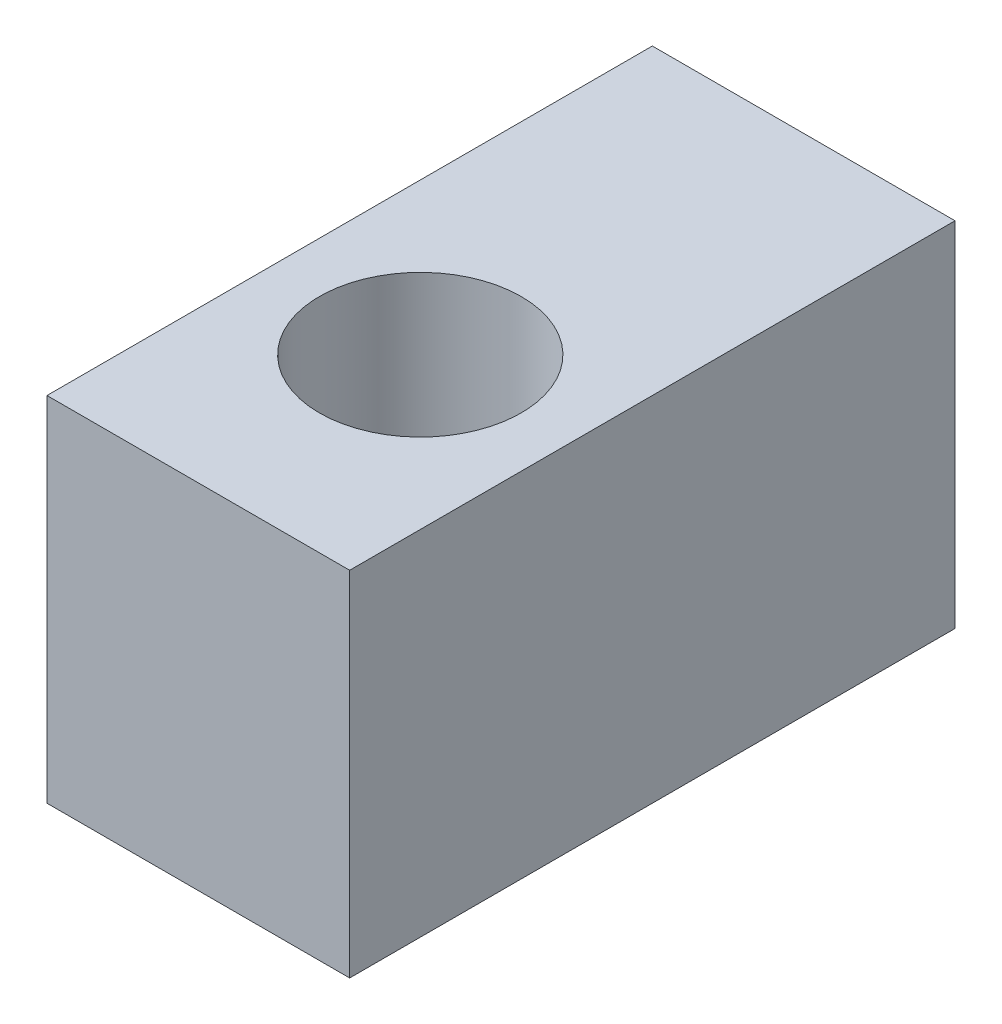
SolidWorks part; units mm, degrees
ref_plane "Front Plane" through (0, 0, 0) normal (0, 0, 1) x (1, 0, 0)
ref_plane "Top Plane" through (0, 0, 0) normal (0, 1, 0) x (1, 0, 0)
ref_plane "Right Plane" through (0, 0, 0) normal (1, 0, 0) x (0, 0, -1)
sketch "Sketch1" plane through (0, 0, 0) normal (0, 0, 1) x (1, 0, 0)
  line L1 (0, 0) -> (30, 0)
  line L2 (0, 0) -> (0, -35)
  line L3 (0, -35) -> (30, -35)
  line L4 (30, 0) -> (30, -35)
  dimension "D1" = 35
  dimension "D2" = 30
extrude "Boss-Extrude1" add sketch "Sketch1" along normal blind 60
sketch "Sketch2" plane through (0, 0, 0) normal (0, 1, 0) x (1, 0, 0)
  line L0 (15, -60) -> (15, -38) construction
  line L1 (30, -60) -> (0, -60) construction
  circle A0 centre (15, -38) radius 10
  dimension "D2" = 20
  dimension "D1" = 22
extrude "Cut-Extrude1" cut sketch "Sketch2" against normal blind 34
